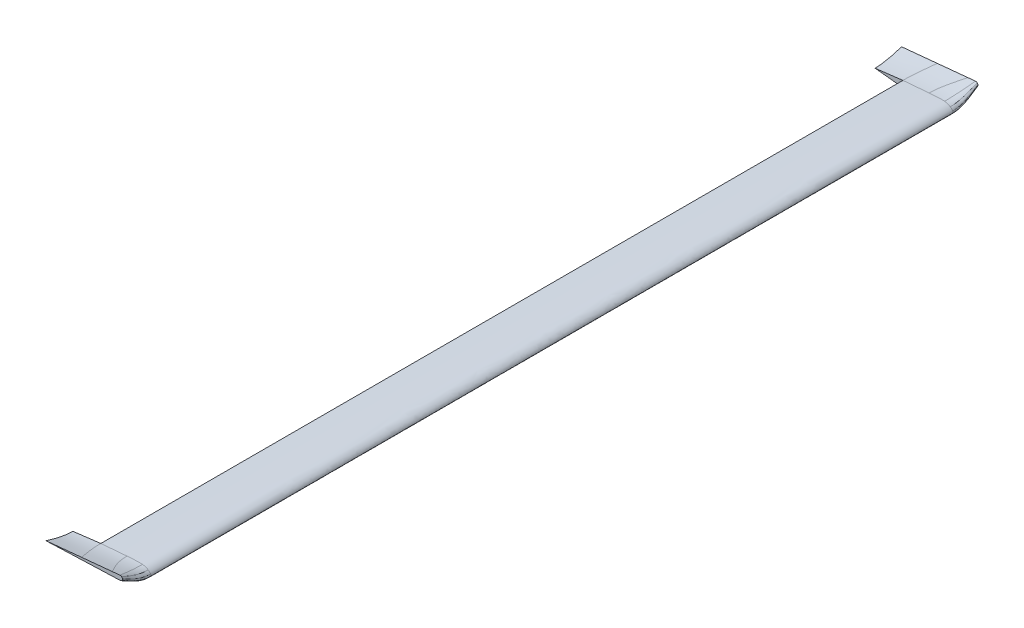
SolidWorks part; units mm, degrees
ref_plane "XY" through (0, 0, 0) normal (0, 0, 1) x (1, 0, 0)
ref_plane "XZ" through (0, 0, 0) normal (0, 1, 0) x (1, 0, 0)
ref_plane "YZ" through (0, 0, 0) normal (1, 0, 0) x (0, 0, -1)
sketch "Sketch1" plane through (0, 0, 0) normal (0, 0, 1) x (1, 0, 0)
  line L0 (50, 0) -> (-50, 0) construction
  line L1 (0, 0) -> (0, 18.796)
  arc A0 (0, 18.796) -> (-19.304, 38.1) centre (-19.304, 18.796) ccw
  spline_without_curve S0
  dimension "D6" = 19.304
  dimension "D1" = 38.1
  dimension "D2" = 53.975
  dimension "D3" = 40.3624
  dimension "D4" = 23.6335
  dimension "D5" = 4.2279
  dimension "D7" = 19.304
  dimension "D8" = 185.8559
  dimension "D9" = 219.9829
  dimension "D10" = 246.08
  dimension "D11" = 266.1546
  dimension "D12" = 254.1098
  dimension "D13" = 19.304
extrude "Base-Extrude" add sketch "Sketch1" along normal blind 4572
sketch "Sketch2" plane through (0, 0, 0) normal (0, 0, -1) x (-1, 0, 0)
  line L0 (19.304, 38.1) -> (177.8, 18.796)
  line L1 (0, 0) -> (0, 18.796)
  line L3 (0, 0) -> (177.8, 18.796)
  arc A1 (19.304, 38.1) -> (0, 18.796) centre (19.304, 18.796) ccw
  spline S0 degree 3 poles (-130.2714, 50.5747) (-148.6642, 51.8534) (-177.956, 53.6716) (-207.6599, 55.0474) (-218.3065, 53.8942) knots 0.264423 0.264423 0.264423 0.264423 0.360799 0.416908 0.416908 0.416908 0.416908
  spline S1 degree 3 poles (8859.4291, 6273.2618) (1377.4941, -595.0996) (835.8774, 13.7671) (-240.5039, 56.4351) (-273.9991, 21.2149) (-245.8248, 0.9187) (785.7289, -37.77) (2650.714, 633.9267) (-6640.157, -8090.767) knots -4.973663 -4.973663 -4.973663 -4.973663 0.360799 0.482831 0.518975 0.567931 0.614286 6.186525 6.186525 6.186525 6.186525 only from (19.304, 38.1) to (0, 0)
  spline S2 degree 3 poles (19.304, 38.1) (-30.2517, 42.5832) (-79.8075, 47.0665) (-130.2714, 50.5747) knots 0 0 0 0 0.264423 0.264423 0.264423 0.264423
  spline S3 degree 3 poles (-218.3065, 53.8942) (-229.6454, 52.6659) (-240.6629, 49.5554) (-250.9493, 42.6302) knots 0.416908 0.416908 0.416908 0.416908 0.476665 0.476665 0.476665 0.476665
  spline S4 degree 3 poles (-250.9493, 42.6302) (-252.0107, 41.9156) (-257.3198, 38.1103) (-262.4197, 33.2198) (-264.5775, 29.1617) knots 0.476665 0.476665 0.476665 0.476665 0.482831 0.507735 0.507735 0.507735 0.507735
  spline S5 degree 3 poles (-264.5775, 29.1617) (-265.5514, 27.33) (-268.6616, 17.3699) (-245.8248, 0.9187) (-158.2732, -2.3649) (-74.6509, -1.1154) (0, 0) knots 0.507735 0.507735 0.507735 0.507735 0.518975 0.567931 0.614286 1 1 1 1
  point P5 (-399.5073, 165.0225)
  point P8 (-206.8093, 49.1727)
  dimension "D2" = 177.8
  dimension "D3" = 18.796
  dimension "D1" = 0
ref_plane "Plane4" through (0, 0, -152.4) normal (0, 0, 1) x (1, 0, 0)
sketch "Sketch3" plane through (0, 0, -152.4) normal (0, 0, 1) x (1, 0, 0)
  line L0 (242.4215, 88.8403) -> (198.8047, 84.596)
  line L1 (244.1221, 63.5087) -> (203.7228, 62.0107)
  line L2 (41.5395, 55.9969) -> (-179.2154, 47.8112)
  line L3 (198.8047, 84.596) -> (24.2437, 67.6096)
  line L4 (24.2437, 67.6096) -> (-179.2154, 47.8112)
  line L5 (203.7228, 62.0107) -> (41.5395, 55.9969)
  arc A0 (244.1221, 63.5087) -> (256.3515, 76.2) centre (243.6515, 76.2) ccw
  arc A1 (251.907, 85.8507) -> (242.4215, 88.8403) centre (243.6515, 76.2) ccw
  arc A2 (256.3515, 76.2) -> (251.907, 85.8507) centre (243.6515, 76.2) ccw
  dimension "D1" = 12.7
  dimension "D2" = 76.2
  dimension "D5" = 423.3375
loft "Boss-Loft4" add profiles "Sketch2", "Sketch3"
ref_plane "Plane5" through (0, 0, 2286) normal (0, 0, 1) x (1, 0, 0)
mirror "Mirror1" about plane through (0, 0, 2286) normal (0, 0, 1) of "Boss-Loft4"
ref_plane "Plane6" through (127, 0, 0) normal (1, 0, 0) x (0, 0, -1)
sketch "Sketch4" plane through (127, 0, 0) normal (1, 0, 0) x (0, 0, -1)
  line L0 (-2564.5452, 1.2221) -> (-2553.8067, -35.7754)
  line L1 (-2515.4548, 1.2221) -> (-2526.1933, -35.7754)
  line L2 (-2564.5452, 1.2221) -> (-2515.4548, 1.2221)
  line L3 (-2286, 169.4769) -> (-2286, -151.4489) construction
  line L4 (-2286, 50) -> (-2286, -50) construction
  line L8 (-2007.4548, 1.2221) -> (-2056.5452, 1.2221)
  line L9 (-2056.5452, 1.2221) -> (-2045.8067, -35.7754)
  line L10 (-2007.4548, 1.2221) -> (-2018.1933, -35.7754)
  arc A0 (-2553.8067, -35.7754) -> (-2526.1933, -35.7754) centre (-2540, -31.768) ccw
  circle A1 centre (-2540, -31.768) radius 4.0074
  circle A2 centre (-2032, -31.768) radius 4.0074
  arc A3 (-2018.1933, -35.7754) -> (-2045.8067, -35.7754) centre (-2032, -31.768) cw
  dimension "D1" = 14.3765
  dimension "D5" = 8.0148
  dimension "D2" = 32.9901
  dimension "D3" = 254
  dimension "D4" = 49.0904
extrude "Boss-Extrude1" add sketch "Sketch4" along normal blind 6.35
